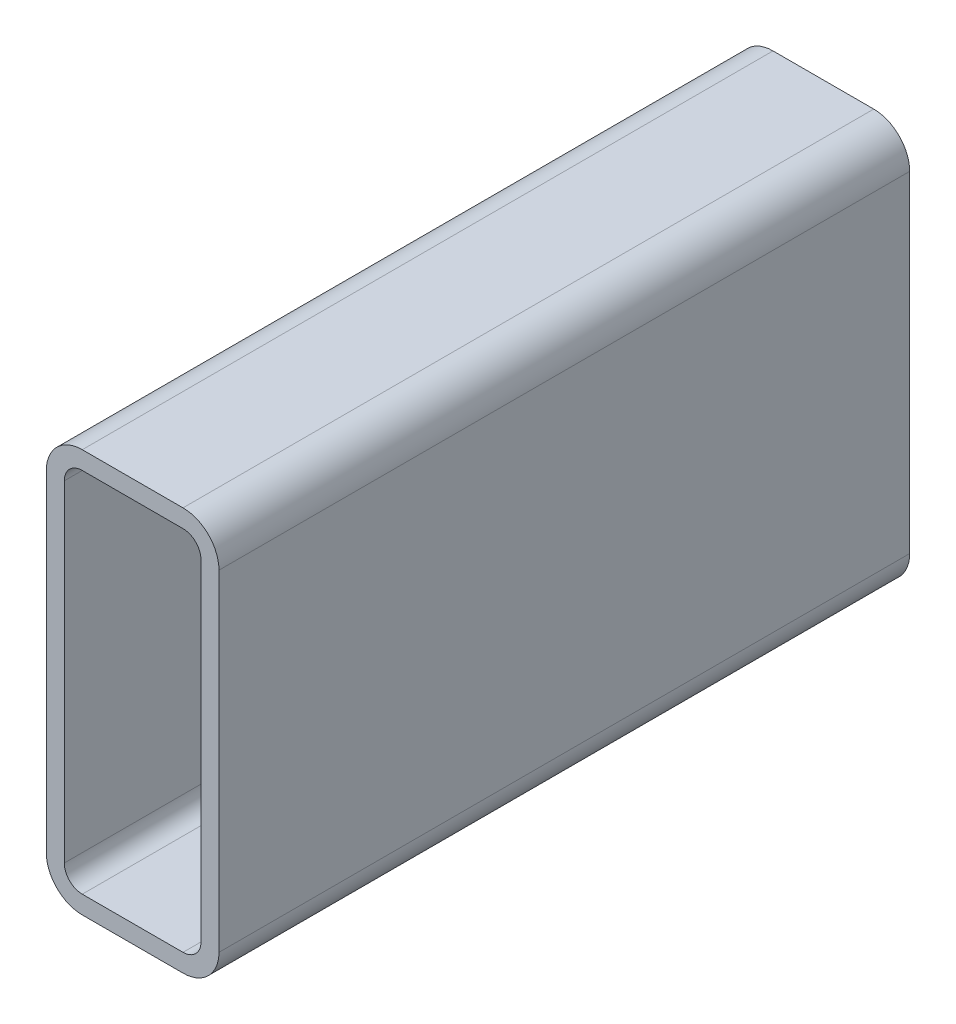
SolidWorks part; units mm, degrees
ref_plane "Front Plane" through (0, 0, 0) normal (0, 0, 1) x (1, 0, 0)
ref_plane "Top Plane" through (0, 0, 0) normal (0, 1, 0) x (1, 0, 0)
ref_plane "Right Plane" through (0, 0, 0) normal (1, 0, 0) x (0, 0, -1)
sketch "Sketch1" plane through (0, 0, 0) normal (0, 0, 1) x (1, 0, 0)
sketch_block_instance "HSS7x3x0.3125-1"
sketch_block "HSS7x3x0.3125"
extrude "Boss-Extrude1" add sketch "Sketch1" along normal blind 304.8
